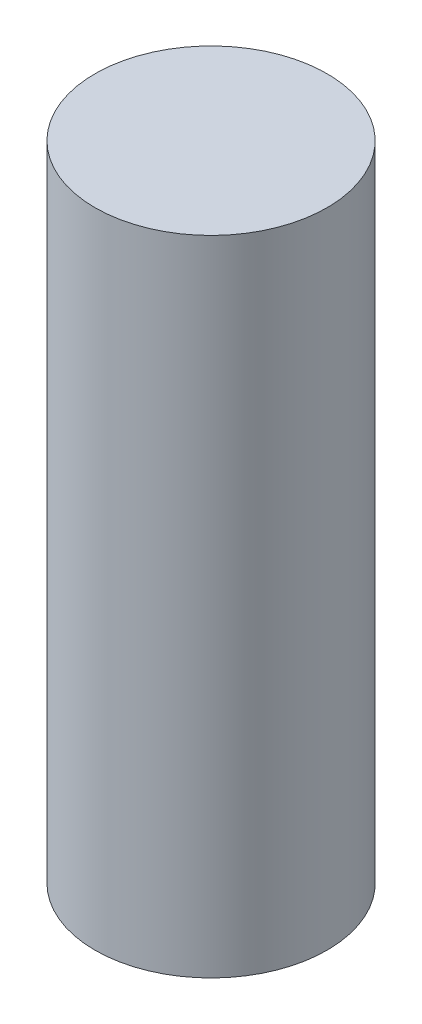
SolidWorks part; units mm, degrees
ref_plane "Front" through (0, 0, 0) normal (0, 0, 1) x (1, 0, 0)
ref_plane "Top" through (0, 0, 0) normal (0, 1, 0) x (1, 0, 0)
ref_plane "Right" through (0, 0, 0) normal (1, 0, 0) x (0, 0, -1)
sketch "Sketch1" plane through (0, 0, 0) normal (0, 1, 0) x (1, 0, 0)
  circle A0 centre (0, 0) radius 36.0938
extrude "Extrude1" add sketch "Sketch1" along normal blind 200
sketch "Sketch2" plane through (0, 200, 0) normal (0, 1, 0) x (-1, 0, 0)
  line L1 (-30.9371, -89.6059) -> (62.1324, -71.5952)
  line L2 (62.1324, -71.5952) -> (93.0695, 18.0106)
  line L3 (93.0695, 18.0106) -> (30.9371, 89.6059)
  line L4 (30.9371, 89.6059) -> (-62.1324, 71.5952)
  line L5 (-62.1324, 71.5952) -> (-93.0695, -18.0106)
  line L6 (-93.0695, -18.0106) -> (-30.9371, -89.6059)
  circle A0 centre (0, 0) radius 82.0959 construction
